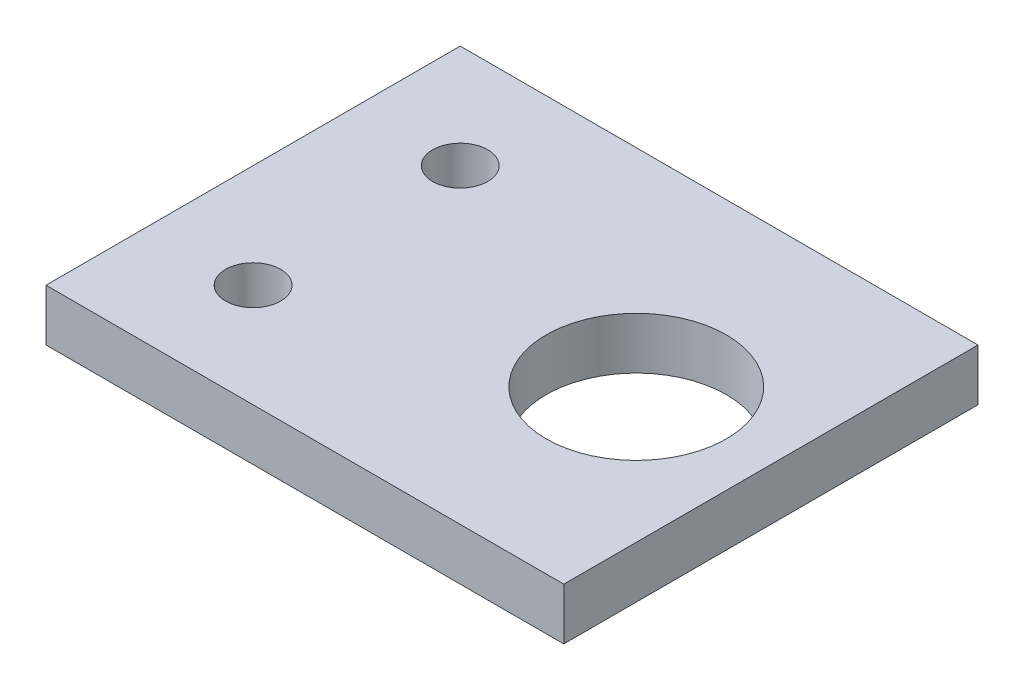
SolidWorks part; units mm, degrees
ref_plane "Front Plane" through (0, 0, 0) normal (0, 0, 1) x (1, 0, 0)
ref_plane "Top Plane" through (0, 0, 0) normal (0, 1, 0) x (1, 0, 0)
ref_plane "Right Plane" through (0, 0, 0) normal (1, 0, 0) x (0, 0, -1)
sketch "Sketch1" plane through (0, 0, 0) normal (0, 1, 0) x (1, 0, 0)
  line L1 (31.75, 25.4) -> (-31.75, 25.4)
  line L2 (31.75, 25.4) -> (31.75, -25.4)
  line L3 (31.75, -25.4) -> (-31.75, -25.4)
  line L4 (-31.75, 25.4) -> (-31.75, -25.4)
  line L5 (31.75, 25.4) -> (-31.75, -25.4) construction
  line L6 (31.75, -25.4) -> (-31.75, 25.4) construction
  point P0 (0, 0)
  dimension "D1" = 50.8
  dimension "D2" = 63.5
extrude "Boss-Extrude1" add sketch "Sketch1" along normal blind 6.35
hole_wizard "H (0.266) Diameter Hole1" positions "Sketch2" profile "Sketch3" hole size "H" standard "ANSI Inch"
sketch "Sketch2" plane through (0, 6.35, 0) normal (0, 1, 0) x (1, 0, 0)
  point P2 (-19.05, -12.7)
  point P6 (-19.05, 12.7)
  dimension "D1" = 25.4
  dimension "D2" = 12.7
  dimension "D3" = 19.05
sketch "Sketch3" plane through (-19.05, 6.35, 12.7) normal (1, 0, 0) x (0, 0, 1)
  line L0 (0, 0) -> (0, 6.35)
  line L1 (0, 6.35) -> (3.3782, 6.35)
  line L2 (3.3782, 6.35) -> (3.3782, 0)
  line L5 (3.3782, 0) -> (0, 0)
  line L11 (0, -6.35) -> (0, 107.95) construction
  dimension "Thru Hole Dia." = 6.7564
  dimension "Thru Hole Depth" = 6.35
sketch "Sketch4" plane through (0, 6.35, 0) normal (0, 1, 0) x (1, 0, 0)
  circle A0 centre (15.24, 0) radius 11.049
  point P2 (15.24, 3.8061)
  dimension "D1" = 15.24
  dimension "D2" = 0
extrude "Cut-Extrude1" cut sketch "Sketch4" against normal through all
sketch "Sketch5" plane through (0, 6.35, 0) normal (0, 1, 0) x (1, 0, 0)
  point P0 (0, 0)
